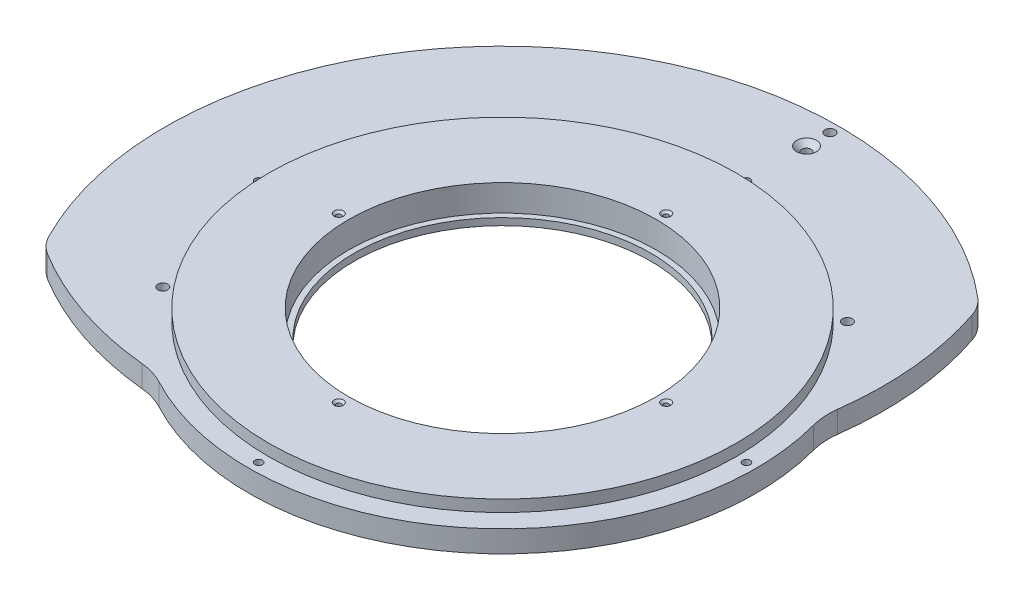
SolidWorks part; units mm, degrees
ref_plane "FRONT" through (0, 0, 0) normal (0, 0, 1) x (1, 0, 0)
ref_plane "TOP" through (0, 0, 0) normal (0, 1, 0) x (1, 0, 0)
ref_plane "RIGHT" through (0, 0, 0) normal (1, 0, 0) x (0, 0, -1)
ref_plane "PlateCamBtmPlane" through (0, 1203.325, 0) normal (0, 1, 0) x (-1, 0, 0)
sketch "Sketch1" plane through (0, 1203.325, 0) normal (0, 1, 0) x (-1, 0, 0)
  line L0 (0, 0) -> (-166.6875, 0) construction
  line L1 (-127, 0) -> (-130.9626, -6.8635) construction
  line L2 (0, 0) -> (-165.7744, -17.4236) construction
  line L3 (0, 0) -> (-163.045, -34.6563) construction
  line L4 (0, 0) -> (-166.4591, -8.7237) construction
  line L5 (0, 0) -> (-164.6353, -26.0757) construction
  line L6 (-130.9626, -6.8635) -> (-134.678, -14.1552) construction
  line L7 (-134.678, -14.1552) -> (-138.1152, -21.8753) construction
  line L8 (-138.1152, -21.8753) -> (-141.2424, -30.022) construction
  line L9 (0, 0) -> (-161.0078, -43.1419) construction
  line L10 (0, 0) -> (-158.5292, -51.5093) construction
  line L11 (-141.2424, -30.022) -> (-144.0269, -38.5919) construction
  line L12 (-144.0269, -38.5919) -> (-146.4352, -47.5797) construction
  line L13 (0, 0) -> (-155.6162, -59.7355) construction
  line L14 (0, 0) -> (-152.2766, -67.7979) construction
  line L15 (0, 0) -> (-148.5197, -75.6745) construction
  line L16 (-146.4352, -47.5797) -> (-148.4329, -56.978) construction
  line L17 (-148.4329, -56.978) -> (-149.985, -66.7776) construction
  line L18 (-149.985, -66.7776) -> (-150.4981, -71.6593) construction
  line L19 (-150.4981, -71.6593) -> (0, 0) construction
  arc A0 (-148.5197, -75.6745) -> (-150.4981, -71.6593) centre (0, 0) ccw construction
  circle A1 centre (0, 0) radius 127 construction
  arc A2 (-127, 0) -> (-150.4981, -71.6593) centre (13.9855, -85.9134) ccw
  dimension "D1" = 166.6875
  dimension "D2" = 127
  dimension "D22" = 165.1
  dimension "D3" = 60
  dimension "D4" = 6
  dimension "D5" = 12
  dimension "D6" = 3
  dimension "D7" = 9
  dimension "D8" = 63
  dimension "D9" = 66
  dimension "D10" = 69
  dimension "D11" = 15
  dimension "D12" = 18
  dimension "D13" = 72
  dimension "D14" = 75
  dimension "D15" = 21
  dimension "D16" = 24
  dimension "D17" = 27
  dimension "D18" = 78
  dimension "D19" = 81
  dimension "D20" = 84
  dimension "D21" = 58.539
sketch "Sketch2" plane through (0, 0, 0) normal (0, 1, 0) x (1, 0, 0)
  line L0 (0, 0) -> (166.6875, 0) construction
  line L1 (0, 0) -> (166.6875, 0) construction
  line L2 (-13.9855, 85.9134) -> (130.0696, 5.2526) construction
  line L3 (0, 0) -> (126.8599, -5.964) construction
  line L4 (0, 0) -> (146.7885, 78.98) construction
  line L5 (149.5855, 63.4962) -> (-13.9855, 85.9134) construction
  arc A0 (126.8599, -5.964) -> (130.0696, 5.2526) centre (152.2319, -7.1567) cw
  circle A1 centre (0, 0) radius 127 construction
  arc A2 (146.7885, 78.98) -> (166.6875, 0) centre (0, 0) ccw construction
  arc A3 (113.1578, 57.6568) -> (126.8599, -5.964) centre (0, 0) ccw construction
  arc A4 (130.0696, 5.2526) -> (149.5855, 63.4962) centre (-13.9855, 85.9134) ccw
  arc A5 (146.7885, 78.98) -> (149.5855, 63.4962) centre (124.4208, 66.945) cw
  point P13 (127, 0)
  dimension "D2" = 166.6875
  dimension "D3" = 25.4
  dimension "D4" = 25.4
  dimension "D1" = 165.1
sketch "PathSketch" plane through (0, 1203.325, 0) normal (0, 1, 0) x (1, 0, 0)
  line L0 (0, 0) -> (122.6726, 32.87) construction
  line L1 (0, 0) -> (166.6875, 0) construction
  line L2 (0, 0) -> (107.1447, 127.69) construction
  line L3 (0, 0) -> (-148.5197, -75.6745) construction
  line L4 (114.9122, 116.2713) -> (97.1274, 169.577) construction
  line L5 (107.1447, 127.69) -> (145.7517, 95.2949) construction
  line L6 (-148.5197, -75.6745) -> (-121.3507, -128.9966) construction
  line L7 (0, 0) -> (-59.6229, -112.1343) construction
  line L8 (-139.1409, -85.8117) -> (-101.9135, -108.5805) construction
  line L9 (0, 0) -> (-72.1163, -108.9558) construction
  arc A0 (107.1447, 127.69) -> (-148.5197, -75.6745) centre (0, 0) ccw construction
  arc A1 (-59.6229, -112.1343) -> (122.6726, 32.87) centre (0, 0) ccw construction
  arc A2 (122.6726, 32.87) -> (122.0193, 42.7207) centre (147.2071, 39.444) cw construction
  arc A3 (122.0193, 42.7207) -> (114.9122, 116.2713) centre (-41.7011, 64.0192) ccw construction
  arc A4 (107.1447, 127.69) -> (114.9122, 116.2713) centre (90.8179, 108.2325) cw construction
  arc A5 (-148.5197, -75.6745) -> (-139.1409, -85.8117) centre (-125.8881, -64.1432) ccw construction
  arc A6 (-139.1409, -85.8117) -> (-69.0742, -109.2819) centre (-52.9977, 55.0335) ccw construction
  arc A7 (-69.0742, -109.2819) -> (-59.6229, -112.1343) centre (-71.5475, -134.5612) cw construction
  arc A16 (-135.8012, -80.3512) -> (-68.4509, -102.9115) centre (-52.9977, 55.0335) ccw
  arc A17 (-142.8165, -72.7686) -> (-135.8012, -80.3512) centre (-125.8881, -64.1432) ccw
  arc A18 (103.0303, 122.7867) -> (-142.8165, -72.7686) centre (0, 0) ccw
  arc A19 (103.0303, 122.7867) -> (108.8404, 114.2455) centre (90.8179, 108.2325) cw
  arc A20 (115.672, 43.5464) -> (108.8404, 114.2455) centre (-41.7011, 64.0192) ccw
  arc A21 (116.4899, 31.2134) -> (115.672, 43.5464) centre (147.2071, 39.444) cw
  arc A22 (-56.6179, -106.4828) -> (116.4899, 31.2134) centre (0, 0) ccw
  arc A23 (-68.4509, -102.9115) -> (-56.6179, -106.4828) centre (-71.5475, -134.5612) cw
  dimension "D1" = 166.6875
  dimension "D2" = 127
  dimension "D4" = 25.4
  dimension "D5" = 165.1
  dimension "D7" = 25.4
  dimension "D8" = 31.549
  dimension "D11" = 25.4
  dimension "D12" = 165.1
  dimension "D13" = 25.4
  dimension "D3" = 15
  dimension "D6" = 35
  dimension "D9" = 35
  dimension "D10" = 207
  dimension "D14" = 31.549
  dimension "D15" = 236.5
  dimension "D16" = 6.4008
sketch "Sketch3" plane through (0, 1203.325, 0) normal (0, 1, 0) x (-1, 0, 0)
  arc A0 (-122.0193, -42.7207) -> (-122.6726, -32.87) centre (-147.2071, -39.444) ccw construction
  arc A1 (-114.9122, -116.2713) -> (-107.1447, -127.69) centre (-90.8179, -108.2325) ccw construction
  arc A2 (148.5197, 75.6745) -> (139.1409, 85.8117) centre (125.8881, 64.1432) ccw construction
  arc A3 (59.6229, 112.1343) -> (69.0742, 109.2819) centre (71.5475, 134.5612) ccw construction
  arc A4 (139.1409, 85.8117) -> (69.0742, 109.2819) centre (52.9977, -55.0335) ccw construction
  arc A5 (-122.0193, -42.7207) -> (-114.9122, -116.2713) centre (41.7011, -64.0192) ccw construction
  arc A6 (59.6229, 112.1343) -> (-122.6726, -32.87) centre (0, 0) ccw construction
  arc A7 (-107.1447, -127.69) -> (148.5197, 75.6745) centre (0, 0) ccw construction
  arc A8 (-122.0193, -42.7207) -> (-122.6726, -32.87) centre (-147.2071, -39.444) ccw construction
  arc A9 (-114.9122, -116.2713) -> (-107.1447, -127.69) centre (-90.8179, -108.2325) ccw construction
  arc A10 (148.5197, 75.6745) -> (139.1409, 85.8117) centre (125.8881, 64.1432) ccw construction
  arc A11 (59.6229, 112.1343) -> (69.0742, 109.2819) centre (71.5475, 134.5612) ccw construction
  arc A12 (139.1409, 85.8117) -> (69.0742, 109.2819) centre (52.9977, -55.0335) ccw construction
  arc A13 (-122.0193, -42.7207) -> (-114.9122, -116.2713) centre (41.7011, -64.0192) ccw construction
  arc A14 (59.6229, 112.1343) -> (-122.6726, -32.87) centre (0, 0) ccw construction
  arc A15 (-107.1447, -127.69) -> (148.5197, 75.6745) centre (0, 0) ccw construction
  arc A16 (-103.0303, -122.7867) -> (142.8165, 72.7686) centre (0, 0) ccw construction
  arc A17 (-108.8404, -114.2455) -> (-103.0303, -122.7867) centre (-90.8179, -108.2325) ccw construction
  arc A18 (-115.672, -43.5464) -> (-108.8404, -114.2455) centre (41.7011, -64.0192) ccw construction
  arc A19 (-115.672, -43.5464) -> (-116.4899, -31.2134) centre (-147.2071, -39.444) ccw construction
  arc A20 (56.6179, 106.4828) -> (-116.4899, -31.2134) centre (0, 0) ccw construction
  arc A21 (56.6179, 106.4828) -> (68.4509, 102.9115) centre (71.5475, 134.5612) ccw construction
  arc A22 (135.8012, 80.3512) -> (68.4509, 102.9115) centre (52.9977, -55.0335) ccw construction
  arc A23 (142.8165, 72.7686) -> (135.8012, 80.3512) centre (125.8881, 64.1432) ccw construction
  arc A24 (-103.0303, -122.7867) -> (142.8165, 72.7686) centre (0, 0) ccw
  arc A25 (-108.8404, -114.2455) -> (-103.0303, -122.7867) centre (-90.8179, -108.2325) ccw
  arc A26 (-115.672, -43.5464) -> (-108.8404, -114.2455) centre (41.7011, -64.0192) ccw
  arc A27 (-115.672, -43.5464) -> (-116.4899, -31.2134) centre (-147.2071, -39.444) ccw
  arc A28 (56.6179, 106.4828) -> (-116.4899, -31.2134) centre (0, 0) ccw
  arc A29 (56.6179, 106.4828) -> (68.4509, 102.9115) centre (71.5475, 134.5612) ccw
  arc A30 (135.8012, 80.3512) -> (68.4509, 102.9115) centre (52.9977, -55.0335) ccw
  arc A31 (142.8165, 72.7686) -> (135.8012, 80.3512) centre (125.8881, 64.1432) ccw
extrude "Base-Extrude" add sketch "Sketch3" along normal blind 15.875
sketch "Sketch4" plane through (0, 1219.2, 0) normal (0, 1, 0) x (-1, 0, 0)
  circle A1 centre (0, 0) radius 111.125
  circle A2 centre (0, 0) radius 182.5625
  dimension "D2" = 365.125
  dimension "D1" = 222.25
extrude "Cut-Extrude1" cut sketch "Sketch4" against normal blind 5.5562
sketch "Sketch6" plane through (0, 1219.2, 0) normal (0, 1, 0) x (-1, 0, 0)
  circle A0 centre (0, 0) radius 73.0313
  dimension "D1" = 146.0627
extrude "Cut-Extrude2" cut sketch "Sketch6" against normal blind 12.5476
sketch "Sketch7" plane through (0, 1206.6524, 0) normal (0, 1, 0) x (-1, 0, 0)
  circle A0 centre (0, 0) radius 70.4215
  dimension "D1" = 140.843
extrude "Cut-Extrude3" cut sketch "Sketch7" against normal through all
sketch " kdonfastener loc sketch" plane through (0, 1219.2, 0) normal (0, 1, 0) x (-1, 0, 0)
  line L0 (0, -87.0199) -> (0, 85.1831) construction
  line L1 (85.1905, 0) -> (-83.7428, 0) construction
  circle A0 centre (0, 0) radius 77.7875 construction
  dimension "D1" = 155.575
sketch "Sketch9" plane through (-78.6348, 1219.2, 20.2743) normal (0, 1, 0) x (-1, 0, 0)
  line L0 (6.5557, -20.2743) -> (-162.3776, -20.2743) construction
  circle A0 centre (-78.6348, -20.2743) radius 77.7875 construction
  point P0 (-0.8473, -20.2743)
hole_wizard "CSK for M2 Countersunk Raised Head Screw1" positions "Sketch9" profile "Sketch10" countersink size "M2" standard "ISO"
sketch "Sketch10" plane through (-77.7875, 1219.2, 0) normal (1, 0, 0) x (0, 0, 1)
  line L0 (0, 0) -> (0, 26.121)
  line L1 (0, 26.121) -> (1.2, 25.4)
  line L2 (1.2, 25.4) -> (1.2, 1)
  line L3 (1.2, 1) -> (2.2, 0)
  line L5 (2.2, 0) -> (0, 0)
  line L6 (-1.2, 1) -> (-2.2, 0) construction
  line L10 (0, 26.121) -> (-1.2, 25.4) construction
  line L11 (0, -6.35) -> (0, 107.95) construction
  dimension "Hole Dia." = 2.4
  dimension "Hole Depth" = 25.4
  dimension "Near C'Sink Dia." = 4.4
  dimension "Near C'Sink Angle" = 90
  dimension "Drill Angle" = 118
sketch "ocam fastener loc sketch" plane through (0, 0, 0) normal (0, 1, 0) x (1, 0, 0)
  line L0 (0, 150.0088) -> (0, -150.0088) construction
  line L1 (0, 0) -> (135.9866, 135.9866) construction
  line L2 (-179.7353, 0) -> (179.7353, 0) construction
  line L3 (0, 0) -> (-136.7004, -95.7187) construction
  circle A0 centre (0, 0) radius 115.8875 construction
  dimension "D1" = 231.775
  dimension "D2" = 45
  dimension "D3" = 215
sketch "Sketch18" plane through (9.4226, 1213.6437, 147.1246) normal (0, 1, 0) x (-1, 0, 0)
  line L0 (9.4226, -297.1334) -> (9.4226, 2.8841) construction
  circle A0 centre (9.4226, -147.1246) radius 115.8875 construction
  point P0 (9.4226, -31.2371)
hole_wizard "CSK for M1.6 Countersunk Flat Head Screw1" positions "Sketch18" profile "Sketch19" countersink size "M1.6" standard "ISO"
sketch "Sketch19" plane through (0, 1213.6437, 115.8875) normal (1, 0, 0) x (0, 0, 1)
  line L0 (0, 0) -> (0, 10.3187)
  line L1 (0, 10.3187) -> (1, 10.3187)
  line L2 (1, 10.3187) -> (1, 3.34)
  line L3 (1, 3.34) -> (1.8, 2.54)
  line L4 (1.8, 2.54) -> (1.8, 0)
  line L6 (1.8, 0) -> (0, 0)
  line L7 (-1, 3.34) -> (-1.8, 2.54) construction
  line L11 (0, -6.35) -> (0, 107.95) construction
  dimension "Thru Hole Dia." = 2
  dimension "Thru Hole Depth" = 10.3187
  dimension "C'Sink Dia." = 3.6
  dimension "C'Sink Angle" = 90
  dimension "Head Clearance" = 2.54
sketch "Sketch26" plane through (95.2794, 1213.6437, -58.2901) normal (0, 1, 0) x (-1, 0, 0)
  line L0 (95.2794, 58.2901) -> (-40.7073, -77.6966) construction
  circle A0 centre (95.2794, 58.2901) radius 115.8875 construction
  point P0 (13.3346, -23.6547)
sketch "Sketch27" plane through (81.9448, 1213.6437, -81.9448) normal (1, 0, 0) x (0, 0, 1)
  line L0 (0, 0) -> (0, 203.2)
  line L1 (0, 203.2) -> (2.1828, 203.2)
  line L2 (2.1828, 203.2) -> (2.1828, 14.2875)
  line L3 (2.1828, 14.2875) -> (2.3686, 14.2875)
  line L4 (2.3686, 14.2875) -> (2.3686, 0)
  line L5 (2.3686, 0) -> (0, 0)
  line L6 (0, 110) -> (0, -10) construction
  dimension "Diameter" = 4.3656
  dimension "Depth" = 203.2
  dimension "C-Bore Diameter" = 4.7371
  dimension "C-Bore Depth" = 14.2875
hole_wizard "Hole9" positions "Sketch26" profile "Sketch27" legacy
sketch "Sketch28" plane through (59.1419, 1213.6437, -64.1415) normal (0, 1, 0) x (-1, 0, 0)
  line L0 (-22.803, -15.4348) -> (-22.803, -16.8111)
  line L10 (-20.4344, -17.8033) -> (-21.8108, -17.8033)
  line L11 (-20.7517, -18.9876) -> (-21.9437, -18.2994)
  line L12 (-20.4704, -18.2146) -> (-21.8258, -17.9756)
  line L13 (-20.5772, -18.6134) -> (-21.8706, -18.1427)
  line L14 (-21.6187, -19.8545) -> (-22.3069, -18.6626)
  line L15 (-21.2805, -19.6177) -> (-22.1652, -18.5634)
  line L16 (-21.9929, -20.029) -> (-22.4636, -18.7357)
  line L17 (-20.9885, -19.3258) -> (-22.0429, -18.4411)
  line L18 (-22.3917, -20.1359) -> (-22.6307, -18.7804)
  line L20 (-22.803, -18.7955) -> (-22.803, -20.1719)
  line L21 (-23.1423, -16.871) -> (-23.613, -15.5776)
  line L22 (-22.9752, -16.8262) -> (-23.2142, -15.4708)
  line L23 (-23.299, -16.9441) -> (-23.9872, -15.7521)
  line L24 (-23.4407, -17.0433) -> (-24.3254, -15.9889)
  line L25 (-23.6622, -17.3072) -> (-24.8542, -16.619)
  line L26 (-23.563, -17.1656) -> (-24.6174, -16.2808)
  line L27 (-23.7951, -17.8033) -> (-25.1715, -17.8033)
  line L31 (-23.7801, -17.631) -> (-25.1355, -17.392)
  line L32 (-23.7353, -17.464) -> (-25.0287, -16.9932)
  circle A0 centre (-22.803, -17.8033) radius 2.3686
  circle A1 centre (-22.803, -17.8033) radius 0.9922
  dimension "D12" = 10
  dimension "D18" = 4.7371
  dimension "D19" = 1.9844
  dimension "D1" = 10
  dimension "D10" = 10
  dimension "D11" = 10
  dimension "D13" = 10
  dimension "D14" = 10
  dimension "D15" = 10
  dimension "D16" = 10
  dimension "D17" = 10
other "PF_.18751"
sketch "Sketch29" plane through (-97.2624, 1213.6437, 91.5504) normal (0, 1, 0) x (-1, 0, 0)
  line L0 (-97.2624, -91.5504) -> (39.438, 4.1683) construction
  circle A0 centre (-97.2624, -91.5504) radius 115.8875 construction
  point P0 (-2.3329, -25.0801)
sketch "Sketch30" plane through (-94.9295, 1213.6437, 66.4703) normal (1, 0, 0) x (0, 0, 1)
  line L0 (0, 0) -> (0, 203.2)
  line L1 (0, 203.2) -> (2.1828, 203.2)
  line L2 (2.1828, 203.2) -> (2.1828, 14.2875)
  line L3 (2.1828, 14.2875) -> (2.3686, 14.2875)
  line L4 (2.3686, 14.2875) -> (2.3686, 0)
  line L5 (2.3686, 0) -> (0, 0)
  line L6 (0, 110) -> (0, -10) construction
  dimension "Diameter" = 4.3656
  dimension "Depth" = 203.2
  dimension "C-Bore Diameter" = 4.7371
  dimension "C-Bore Depth" = 14.2875
hole_wizard "Hole10" positions "Sketch29" profile "Sketch30" legacy
sketch "Sketch31" plane through (-117.7324, 1213.6437, 84.2737) normal (0, 1, 0) x (-1, 0, 0)
  line L0 (-22.803, -15.4348) -> (-22.803, -16.8111)
  line L10 (-20.4344, -17.8033) -> (-21.8108, -17.8033)
  line L11 (-20.7517, -18.9876) -> (-21.9437, -18.2994)
  line L12 (-20.4704, -18.2146) -> (-21.8258, -17.9756)
  line L13 (-20.5772, -18.6134) -> (-21.8706, -18.1427)
  line L14 (-21.6187, -19.8545) -> (-22.3069, -18.6626)
  line L15 (-21.2805, -19.6177) -> (-22.1652, -18.5634)
  line L16 (-21.9929, -20.029) -> (-22.4636, -18.7357)
  line L17 (-20.9885, -19.3258) -> (-22.0429, -18.4411)
  line L18 (-22.3917, -20.1359) -> (-22.6307, -18.7804)
  line L20 (-22.803, -18.7955) -> (-22.803, -20.1719)
  line L21 (-23.1423, -16.871) -> (-23.613, -15.5776)
  line L22 (-22.9752, -16.8262) -> (-23.2142, -15.4708)
  line L23 (-23.299, -16.9441) -> (-23.9872, -15.7521)
  line L24 (-23.4407, -17.0433) -> (-24.3254, -15.9889)
  line L25 (-23.6622, -17.3072) -> (-24.8542, -16.619)
  line L26 (-23.563, -17.1656) -> (-24.6174, -16.2808)
  line L27 (-23.7951, -17.8033) -> (-25.1715, -17.8033)
  line L31 (-23.7801, -17.631) -> (-25.1355, -17.392)
  line L32 (-23.7353, -17.464) -> (-25.0287, -16.9932)
  circle A0 centre (-22.803, -17.8033) radius 2.3686
  circle A1 centre (-22.803, -17.8033) radius 0.9922
  dimension "D12" = 10
  dimension "D18" = 4.7371
  dimension "D19" = 1.9844
  dimension "D1" = 10
  dimension "D10" = 10
  dimension "D11" = 10
  dimension "D13" = 10
  dimension "D14" = 10
  dimension "D15" = 10
  dimension "D16" = 10
  dimension "D17" = 10
other "PF_.18752"
sketch "DropoutMtgHoles" plane through (0, 0, 0) normal (0, 1, 0) x (1, 0, 0)
  line L0 (-50, 0) -> (50, 0) construction
  line L1 (0, -50) -> (0, 50) construction
  point P1 (0, 155.575)
  point P2 (0, 144.4625)
  dimension "D1" = 144.4625
  dimension "D2" = 155.575
sketch "Sketch33" plane through (-7.5067, 1213.6438, -118.7185) normal (0, 1, 0) x (-1, 0, 0)
  point P0 (-7.5067, -25.744)
hole_wizard "CSK for M4 Countersunk Raised Head Screw1" positions "Sketch33" profile "Sketch34" countersink size "M4" standard "ISO"
sketch "Sketch34" plane through (0, 1213.6438, -144.4625) normal (1, 0, 0) x (0, 0, 1)
  line L0 (0, 0) -> (0, 10.3188)
  line L1 (0, 10.3188) -> (2.25, 10.3188)
  line L2 (2.25, 10.3188) -> (2.25, 2.45)
  line L3 (2.25, 2.45) -> (4.7, 0)
  line L5 (4.7, 0) -> (0, 0)
  line L6 (-2.25, 2.45) -> (-4.7, 0) construction
  line L11 (0, -6.35) -> (0, 107.95) construction
  dimension "Thru Hole Dia." = 4.5
  dimension "Thru Hole Depth" = 10.3188
  dimension "Near C'Sink Dia." = 9.4
  dimension "Near C'Sink Angle" = 90
sketch "Sketch38" plane through (-6.0989, 1213.6438, -128.7615) normal (0, 1, 0) x (-1, 0, 0)
  point P0 (-6.0989, -26.8135)
sketch "Sketch39" plane through (0, 1213.6438, -155.575) normal (1, 0, 0) x (0, 0, 1)
  line L0 (0, 0) -> (0, 15.5991)
  line L1 (0, 15.5991) -> (2.1828, 14.2875)
  line L2 (2.1828, 14.2875) -> (2.1828, 7.1437)
  line L3 (2.1828, 7.1437) -> (2.394, 7.1437)
  line L4 (2.394, 0) -> (0, 0)
  line L5 (0, -11.3109) -> (0, 121.1557) construction
  line L6 (0, 15.5991) -> (-2.1828, 14.2875) construction
  line L7 (2.394, 7.1437) -> (2.394, 0)
  dimension "Depth" = 14.2875
  dimension "Drill Angle" = 118
  dimension "Diameter" = 4.3656
  dimension "C-Bore Diameter" = 4.7879
  dimension "C-Bore Depth" = 7.1437
hole_wizard "Hole13" positions "Sketch38" profile "Sketch39" legacy
sketch "Sketch40" plane through (-34.6912, 1213.6437, -138.7456) normal (0, 1, 0) x (-1, 0, 0)
  line L0 (-34.6912, -14.4354) -> (-34.6912, -19.2233)
  line L10 (-32.2973, -16.8294) -> (-37.0852, -16.8294)
  line L11 (-32.618, -18.0263) -> (-36.7645, -15.6324)
  line L12 (-32.3337, -17.2451) -> (-37.0488, -16.4137)
  line L13 (-32.4417, -17.6481) -> (-36.9408, -16.0106)
  line L14 (-33.4943, -18.9026) -> (-35.8882, -14.7561)
  line L15 (-33.1524, -18.6632) -> (-36.23, -14.9955)
  line L16 (-33.8725, -19.0789) -> (-35.51, -14.5798)
  line L17 (-32.8574, -18.3682) -> (-36.5251, -15.2906)
  line L18 (-34.2755, -19.1869) -> (-35.1069, -14.4718)
  circle A0 centre (-34.6912, -16.8294) radius 2.394
  dimension "D12" = 10
  dimension "D18" = 4.7879
  dimension "D1" = 10
  dimension "D10" = 10
  dimension "D11" = 10
  dimension "D13" = 10
  dimension "D14" = 10
  dimension "D15" = 10
  dimension "D16" = 10
  dimension "D17" = 10
other "SF_.18751"
pattern_circular "CirPattern1" count 4 over 360 about axis through (0, 0, 0) along (0, 1, 0) of "CSK for M2 Countersunk Raised Head Screw1"
pattern_circular "CirPattern2" count 4 over 360 about axis through (0, 0, 0) along (0, 1, 0) of "CSK for M1.6 Countersunk Flat Head Screw1"
